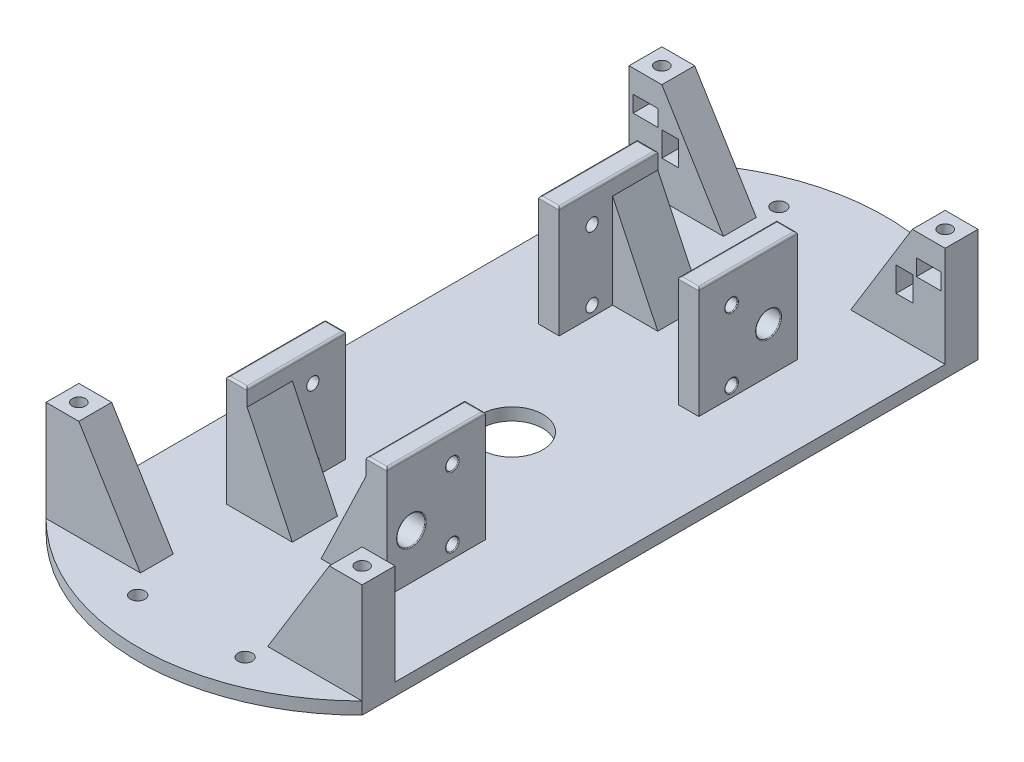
SolidWorks part; units mm, degrees
ref_plane "Front Plane" through (0, 0, 0) normal (0, 0, 1) x (1, 0, 0)
ref_plane "Top Plane" through (0, 0, 0) normal (0, 1, 0) x (1, 0, 0)
ref_plane "Right Plane" through (0, 0, 0) normal (1, 0, 0) x (0, 0, -1)
sketch "Sketch1" plane through (0, 0, 0) normal (0, 1, 0) x (1, 0, 0)
  line L0 (-38.5, 49.1493) -> (-38.5, 0) construction
  line L2 (0, 0) -> (0, -150)
  line L4 (-77, 0) -> (-77, -150)
  line L5 (-38.5, -165.9472) -> (-38.5, -209.0565) construction
  arc A0 (-77, 0) -> (0, 0) centre (-38.5, -38.5) cw
  arc A1 (0, -150) -> (-77, -150) centre (-38.5, -111.5) cw
  dimension "D1" = 77
  dimension "D2" = 150
extrude "Boss-Extrude1" add sketch "Sketch1" along normal blind 3
sketch "Sketch2" plane through (0, 3, 0) normal (0, 1, 0) x (1, 0, 0)
  line L1 (-77, 0) -> (-69, 0)
  line L2 (-77, 0) -> (-77, -8)
  line L3 (-77, -8) -> (-69, -8)
  line L4 (-69, 0) -> (-69, -8)
  line L5 (0, 0) -> (-8, 0)
  line L6 (0, 0) -> (0, -8)
  line L7 (0, -8) -> (-8, -8)
  line L8 (-8, 0) -> (-8, -8)
  line L9 (-77, -150) -> (-69, -150)
  line L10 (-77, -150) -> (-77, -142)
  line L11 (-77, -142) -> (-69, -142)
  line L12 (-69, -150) -> (-69, -142)
  line L13 (0, -150) -> (-8, -150)
  line L14 (0, -150) -> (0, -142)
  line L15 (0, -142) -> (-8, -142)
  line L16 (-8, -150) -> (-8, -142)
  dimension "D1" = 8
  dimension "D2" = 8
  dimension "D3" = 8
  dimension "D4" = 8
  dimension "D5" = 8
  dimension "D6" = 8
  dimension "D7" = 8
  dimension "D8" = 8
extrude "Boss-Extrude2" add sketch "Sketch2" along normal blind 24.5
sketch "Sketch4" plane through (0, 0, 150) normal (0, 0, 1) x (1, 0, 0)
  line L0 (-69, 27.5) -> (-54, 3)
  line L1 (0, 3) -> (-77, 3) construction
  line L2 (-54, 3) -> (-69, 3)
  line L3 (-69, 3) -> (-69, 27.5)
  line L4 (-8, 27.5) -> (-23, 3)
  line L5 (-23, 3) -> (-8, 3)
  line L6 (-8, 3) -> (-8, 27.5)
  dimension "D1" = 15
  dimension "D2" = 15
extrude "Boss-Extrude3" add sketch "Sketch4" against normal blind 8
sketch "Sketch5" plane through (0, 0, 0) normal (0, 0, -1) x (-1, 0, 0)
  line L0 (8, 27.5) -> (23, 3)
  line L1 (8, 27.5) -> (8, 3) construction
  line L2 (8, 27.5) -> (23, 3) construction
  line L3 (77, 3) -> (0, 3) construction
  line L4 (0, 3) -> (23, 3) construction
  line L5 (23, 3) -> (8, 3)
  line L6 (8, 3) -> (8, 27.5)
  line L7 (69, 27.5) -> (54, 3)
  line L8 (54, 3) -> (69, 3)
  line L9 (69, 27.5) -> (69, 3) construction
  line L10 (54, 3) -> (77, 3) construction
  line L11 (69, 3) -> (69, 27.5)
extrude "Boss-Extrude4" add sketch "Sketch5" against normal blind 8
sketch "Sketch6" plane through (0, 3, 0) normal (0, 1, 0) x (1, 0, 0)
  line L0 (-69, -8) -> (-54, -8) construction
  line L1 (-58, -25) -> (-53, -25)
  line L2 (-58, -25) -> (-58, -49)
  line L3 (-58, -49) -> (-53, -49)
  line L4 (-53, -25) -> (-53, -49)
  line L5 (-77, -8) -> (-77, -142) construction
  line L6 (0, -142) -> (0, -8) construction
  line L7 (-19, -25) -> (-24, -25)
  line L8 (-19, -25) -> (-19, -49)
  line L9 (-19, -49) -> (-24, -49)
  line L10 (-24, -25) -> (-24, -49)
  line L11 (-23, -8) -> (0, -8) construction
  line L12 (-54, -142) -> (-77, -142) construction
  line L13 (-58, -101) -> (-53, -101)
  line L14 (-58, -101) -> (-58, -125)
  line L15 (-58, -125) -> (-53, -125)
  line L16 (-53, -101) -> (-53, -125)
  line L17 (-19, -101) -> (-24, -101)
  line L18 (-19, -101) -> (-19, -125)
  line L19 (-19, -125) -> (-24, -125)
  line L20 (-24, -101) -> (-24, -125)
  line L21 (0, -142) -> (-23, -142) construction
  point P6 (-61.5, -8)
  point P15 (-19, -37)
  point P18 (-11.5, -8)
  point P19 (-21.5, -25)
  dimension "D1" = 17
  dimension "D2" = 19
  dimension "D3" = 19
  dimension "D4" = 5
  dimension "D5" = 24
  dimension "D6" = 24
  dimension "D7" = 17
  dimension "D8" = 5
  dimension "D9" = 17
  dimension "D10" = 17
  dimension "D11" = 5
  dimension "D12" = 5
  dimension "D13" = 24
  dimension "D14" = 24
extrude "Boss-Extrude5" add sketch "Sketch6" along normal blind 27
sketch "Sketch7" plane through (-19, 0, 0) normal (1, 0, 0) x (0, 0, -1)
  line L0 (-41, 30) -> (-41, 3) construction
  line L1 (-49, 30) -> (-25, 30) construction
  line L2 (-142, 3) -> (-8, 3) construction
  line L3 (-49, 30) -> (-49, 3) construction
  line L4 (-25, 30) -> (-25, 3) construction
  line L5 (-49, 3) -> (-25, 3) construction
  circle A0 centre (-41, 22.5) radius 1.5
  circle A1 centre (-41, 5.5) radius 1.5
  circle A2 centre (-32, 14) radius 3
  dimension "D3" = 3
  dimension "D5" = 3
  dimension "D8" = 6
  dimension "D1" = 8
  dimension "D2" = 2.5
  dimension "D4" = 17
  dimension "D6" = 7
  dimension "D7" = 11
extrude "Cut-Extrude1" cut sketch "Sketch7" against normal blind 51.26
sketch "Sketch8" plane through (-19, 0, 0) normal (1, 0, 0) x (0, 0, -1)
  line L0 (-109, 30) -> (-109, 3) construction
  line L1 (-125, 30) -> (-101, 30) construction
  line L2 (-142, 3) -> (-8, 3) construction
  line L3 (-101, 30) -> (-101, 3) construction
  line L4 (-125, 3) -> (-101, 3) construction
  line L5 (-125, 30) -> (-125, 3) construction
  circle A0 centre (-109, 23) radius 1.5
  circle A1 centre (-109, 6) radius 1.5
  circle A2 centre (-119, 14) radius 3.4305
  dimension "D3" = 3
  dimension "D4" = 3
  dimension "D1" = 8
  dimension "D2" = 3
  dimension "D5" = 17
  dimension "D6" = 6
  dimension "D7" = 11
extrude "Cut-Extrude2" cut sketch "Sketch8" against normal blind 51.26
sketch "Sketch9" plane through (0, 0, 142) normal (0, 0, -1) x (-1, 0, 0)
  line L0 (8, 27.5) -> (8, 3) construction
  line L1 (0, 3) -> (23, 3) construction
  line L2 (69, 27.5) -> (69, 3) construction
  line L3 (8, 18) -> (12, 18)
  line L4 (8, 18) -> (8, 12)
  line L5 (8, 12) -> (12, 12)
  line L6 (12, 18) -> (12, 12)
  line L7 (69, 27.5) -> (77, 27.5) construction
  line L8 (54, 3) -> (77, 3) construction
  line L10 (69, 18) -> (73, 18)
  line L11 (69, 18) -> (69, 12)
  line L12 (69, 12) -> (73, 12)
  line L13 (73, 18) -> (73, 12)
  dimension "D1" = 15
  dimension "D2" = 6
  dimension "D3" = 4
  dimension "D4" = 4
extrude "Cut-Extrude3" cut sketch "Sketch9" against normal blind 6.8
sketch "Sketch10" plane through (0, 0, 8) normal (0, 0, 1) x (1, 0, 0)
  line L0 (-69, 27.5) -> (-69, 2.4868) construction
  line L1 (-77, 3) -> (-54, 3) construction
  line L2 (-69, 18) -> (-65, 18)
  line L3 (-69, 18) -> (-69, 12)
  line L4 (-69, 12) -> (-65, 12)
  line L5 (-65, 18) -> (-65, 12)
  line L6 (-8, 27.5) -> (-8, 3) construction
  line L7 (-23, 3) -> (0, 3) construction
  line L9 (-8, 18) -> (-4, 18)
  line L10 (-8, 18) -> (-8, 12)
  line L11 (-8, 12) -> (-4, 12)
  line L12 (-4, 18) -> (-4, 12)
  point P18 (-6, 18)
  dimension "D1" = 15
  dimension "D2" = 6
  dimension "D3" = 4
  dimension "D4" = 6
  dimension "D5" = 4
extrude "Cut-Extrude4" cut sketch "Sketch10" against normal blind 6.8
sketch "Sketch11" plane through (0, 0, 125) normal (0, 0, 1) x (1, 0, 0)
  line L0 (-53, 30) -> (-53, 3) construction
  line L1 (-53, 26) -> (-53, 3)
  line L2 (-53, 3) -> (-42, 3)
  line L3 (0, 3) -> (-77, 3) construction
  line L4 (-42, 3) -> (-53, 26)
  line L5 (-24, 26) -> (-35, 3)
  line L6 (-24, 30) -> (-24, 3) construction
  line L7 (-35, 3) -> (-24, 3)
  line L8 (-24, 3) -> (-24, 26)
  dimension "D1" = 23
  dimension "D2" = 11
  dimension "D3" = 11
extrude "Boss-Extrude8" add sketch "Sketch11" against normal blind 11
sketch "Sketch14" plane through (0, 0, 25) normal (0, 0, -1) x (-1, 0, 0)
  line L0 (24, 26) -> (35, 3)
  line L1 (35, 3) -> (24, 3)
  line L2 (24, 3) -> (24, 26)
  line L3 (53, 26) -> (53, 3)
  line L4 (53, 3) -> (42, 3)
  line L5 (42, 3) -> (53, 26)
extrude "Boss-Extrude9" add sketch "Sketch14" against normal blind 11
fillet "Fillet5" radius 0.5 16 edges at (-55.5, 30, 25) (-53, 30, 37) (-55.5, 30, 49) (-58, 30, 37) (-21.5, 30, 125) (-24, 30, 113) (-21.5, 30, 101) (-19, 30, 113) (-55.5, 30, 101) (-53, 30, 113) (-55.5, 30, 125) (-58, 30, 113) (-21.5, 30, 49) (-24, 30, 37) (-21.5, 30, 25) (-19, 30, 37)
fillet "Fillet6" radius 0.2 12 edges at (-58, 14, 115.5695) (-58, 14, 29) (-19, 14, 29) (-19, 5.5, 39.5) (-19, 22.5, 39.5) (-19, 23, 107.5) (-19, 6, 107.5) (-19, 14, 115.5695) (-58, 6, 107.5) (-58, 23, 107.5) (-58, 5.5, 39.5) (-58, 22.5, 39.5)
sketch "Sketch15" plane through (0, 3, 0) normal (0, 1, 0) x (1, 0, 0)
  line L0 (-38.5, 15.9472) -> (-38.5, -165.9472) construction
  line L1 (-42, -25) -> (-58, -25) construction
  line L2 (-19, -25) -> (-35, -25) construction
  line L3 (-58, -125) -> (-42, -125) construction
  arc A0 (0, 0) -> (-77, 0) centre (-38.5, -38.5) ccw construction
  arc A1 (-77, -150) -> (0, -150) centre (-38.5, -111.5) ccw construction
  circle A2 centre (-38.5, -75) radius 7.5
  circle A3 centre (-53.5, 5) radius 1.75
  circle A4 centre (-23.5, 5) radius 1.75
  circle A5 centre (-49.6665, -155) radius 1.75
  circle A6 centre (-23.5, -155) radius 1.75
  point P19 (-50, -25)
  dimension "D1" = 15
  dimension "D8" = 3.5
  dimension "D9" = 3.5
  dimension "D10" = 3.5
  dimension "D11" = 3.5
  dimension "D2" = 30
  dimension "D3" = 30
  dimension "D4" = 30
  dimension "D5" = 30
  dimension "D6" = 15
  dimension "D7" = 15
extrude "Cut-Extrude5" cut sketch "Sketch15" against normal blind 11
sketch "Sketch16" plane through (0, 27.5, 0) normal (0, 1, 0) x (1, 0, 0)
  line L0 (-73, -150) -> (-73, 7.0993) construction
  line L1 (-77, -150) -> (-69, -150) construction
  line L2 (-4, -150) -> (-4, 9.6371) construction
  line L3 (-8, -150) -> (0, -150) construction
  line L4 (-77, -146) -> (0, -146) construction
  line L5 (-77, -142) -> (-77, -150) construction
  line L6 (0, -150) -> (0, -142) construction
  line L7 (-77, -4) -> (7.7048, -4) construction
  line L8 (-77, 0) -> (-77, -8) construction
  circle A0 centre (-73, -4) radius 1.6
  circle A1 centre (-73, -146) radius 1.6
  circle A2 centre (-4, -4) radius 1.6
  circle A3 centre (-4, -146) radius 1.6
  dimension "D1" = 3.2
  dimension "D2" = 3.2
  dimension "D3" = 3.2
  dimension "D4" = 3.2
extrude "Cut-Extrude7" cut sketch "Sketch16" against normal blind 7
sketch "Sketch17" plane through (0, 0, 142) normal (0, 0, -1) x (-1, 0, 0)
  line L1 (69, 18) -> (73, 18)
  line L2 (69, 18) -> (69, 12)
  line L3 (69, 12) -> (73, 12)
  line L4 (73, 18) -> (73, 12)
extrude "Boss-Extrude10" add sketch "Sketch17" against normal blind 5.74
sketch "Sketch18" plane through (0, 0, 142) normal (0, 0, -1) x (-1, 0, 0)
  line L0 (8, 18) -> (78.5498, 18) construction
  line L1 (8, 12) -> (78.5498, 12) construction
  line L2 (0, 27.5) -> (0, 3) construction
  line L3 (65.062, 18) -> (69.126, 18)
  line L4 (65.062, 18) -> (65.062, 12)
  line L5 (65.062, 12) -> (69.126, 12)
  line L6 (69.126, 18) -> (69.126, 12)
  line L7 (8, 18) -> (8, 12) construction
  line L8 (77, 27.5) -> (77, 3) construction
  point P15 (69.126, 15)
  dimension "D1" = 8
  dimension "D2" = 7.874
  dimension "D3" = 4.064
extrude "Cut-Extrude8" cut sketch "Sketch18" against normal blind 5
sketch "Sketch19" plane through (0, 0, 8) normal (0, 0, 1) x (1, 0, 0)
  line L1 (-8, 18) -> (-4, 18)
  line L2 (-8, 18) -> (-8, 12)
  line L3 (-8, 12) -> (-4, 12)
  line L4 (-4, 18) -> (-4, 12)
extrude "Boss-Extrude11" add sketch "Sketch19" against normal blind 5.74
sketch "Sketch20" plane through (0, 0, 8) normal (0, 0, 1) x (1, 0, 0)
  line L0 (-69, 18) -> (1.1761, 18) construction
  line L1 (-69, 12) -> (1.1761, 12) construction
  line L3 (-69, 18) -> (-69, 12) construction
  line L4 (-11.938, 18) -> (-7.874, 18)
  line L5 (-11.938, 18) -> (-11.938, 12)
  line L6 (-11.938, 12) -> (-7.874, 12)
  line L7 (-7.874, 18) -> (-7.874, 12)
  line L8 (-77, 27.5) -> (-77, 3) construction
  line L9 (0, 27.5) -> (0, 3) construction
  point P16 (0, 15.25)
  dimension "D1" = 8
  dimension "D2" = 7.874
  dimension "D3" = 4.064
extrude "Cut-Extrude9" cut sketch "Sketch20" against normal blind 5
sketch "Sketch21" plane through (0, 0, 8) normal (0, 0, 1) x (1, 0, 0)
  line L0 (-73, 27.5) -> (-73, 3) construction
  line L1 (-77, 27.5) -> (-69, 27.5) construction
  line L2 (-77, 3) -> (-54, 3) construction
  line L3 (-76, 22) -> (1.2623, 22) construction
  line L4 (-76, 22) -> (-70, 22)
  line L5 (-76, 22) -> (-76, 18)
  line L6 (-76, 18) -> (-70, 18)
  line L7 (-70, 22) -> (-70, 18)
  line L8 (-76, 18) -> (8.9124, 18) construction
  line L9 (-4, 27.5) -> (-4, 3) construction
  line L10 (-8, 27.5) -> (0, 27.5) construction
  line L11 (-23, 3) -> (0, 3) construction
  line L13 (-7, 22) -> (-1, 22)
  line L14 (-7, 22) -> (-7, 18)
  line L15 (-7, 18) -> (-1, 18)
  line L16 (-1, 22) -> (-1, 18)
  dimension "D1" = 6
  dimension "D2" = 3
  dimension "D3" = 4
  dimension "D4" = 5.5
  dimension "D5" = 6
  dimension "D6" = 3
extrude "Cut-Extrude12" cut sketch "Sketch21" against normal blind 7.97 and the other way blind 140.15
